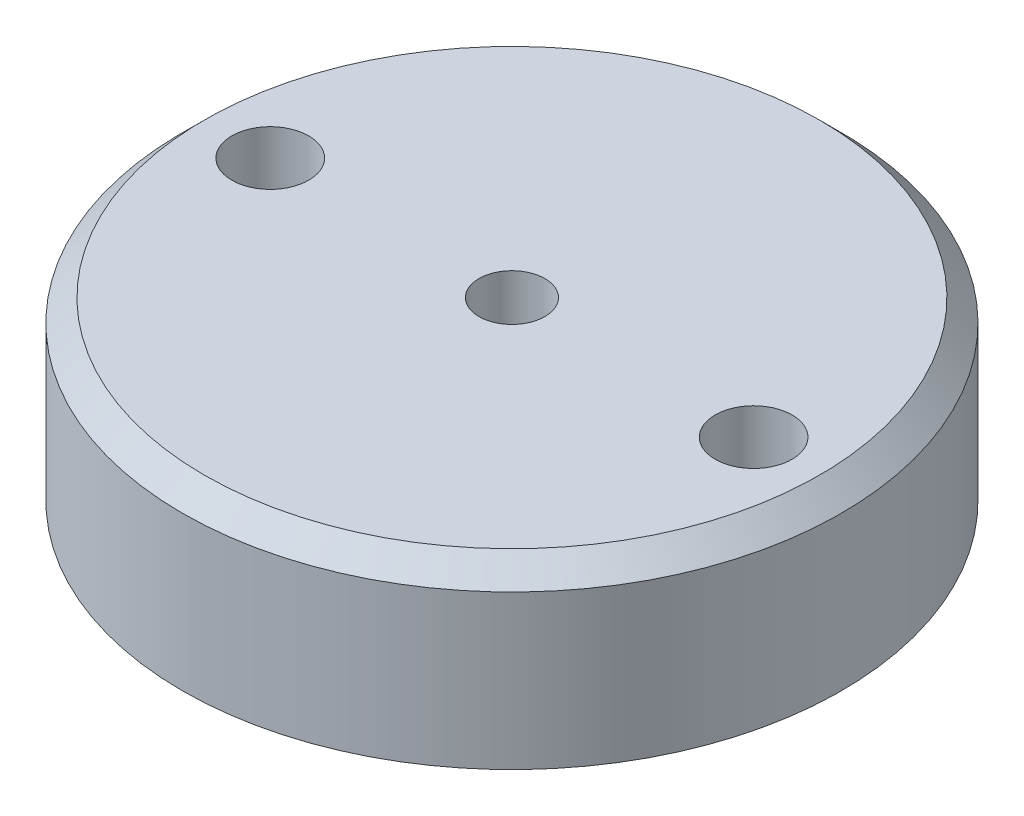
SolidWorks part; units mm, degrees
ref_plane "Front" through (0, 0, 0) normal (0, 0, 1) x (1, 0, 0)
ref_plane "Top" through (0, 0, 0) normal (0, 1, 0) x (1, 0, 0)
ref_plane "Right" through (0, 0, 0) normal (1, 0, 0) x (0, 0, -1)
sketch "Sketch1" plane through (0, 0, 0) normal (0, 1, 0) x (1, 0, 0)
  circle A0 centre (0, 0) radius 15
  circle A1 centre (0, 0) radius 1.5
extrude "Extrude1" add sketch "Sketch1" along normal blind 8
chamfer "Chamfer1" distance 1 angle 45 1 edges at (0, 8, 15)
sketch "Sketch2" plane through (0, 8, 0) normal (0, 1, 0) x (-1, 0, 0)
  circle A1 centre (-11, 0) radius 1.75
  circle A2 centre (11, 0) radius 1.75
extrude "Cut-Extrude1" cut sketch "Sketch2" against normal through all
